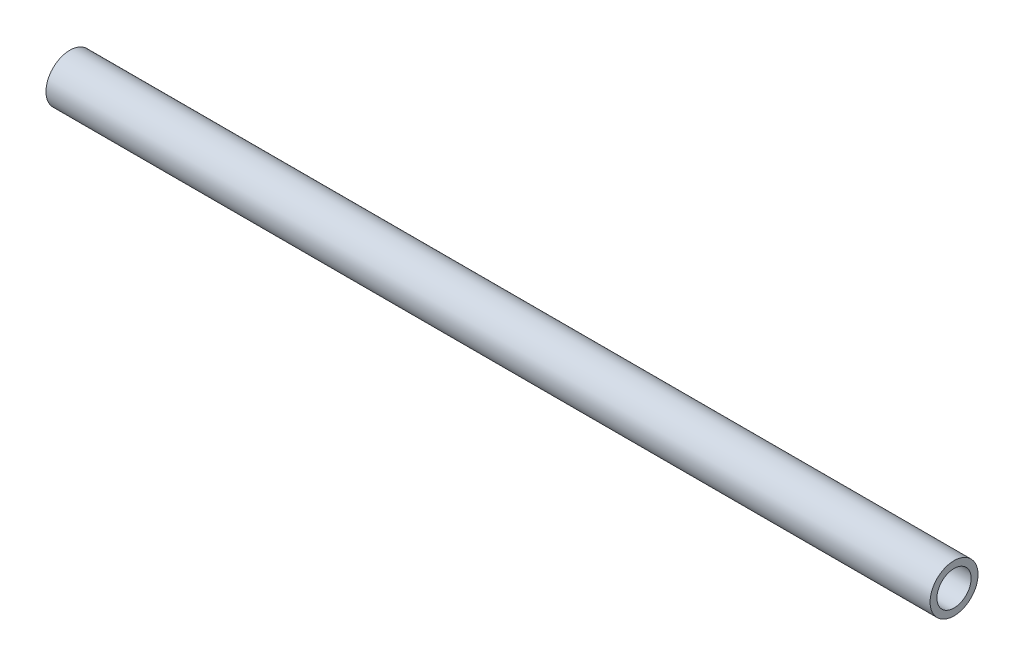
SolidWorks part; units mm, degrees
ref_plane "Front" through (0, 0, 0) normal (0, 0, 1) x (1, 0, 0)
ref_plane "Top" through (0, 0, 0) normal (0, 1, 0) x (1, 0, 0)
ref_plane "Right" through (0, 0, 0) normal (1, 0, 0) x (0, 0, -1)
sketch "Sketch1" plane through (0, 0, 0) normal (0, 0, 1) x (1, 0, 0)
  line L0 (0, 0) -> (393.7, 0)
  line L1 (9.9848, 0) -> (-9.9848, 0) construction
  dimension "D1" = 393.7
other "Structural Member1"
ref_plane "Plane1" through (0, 0, 0) normal (1, 0, 0) x (0, 0, -1)
sketch "Sketch11" plane through (0, 0, 0) normal (1, 0, 0) x (0, 0, -1)
  circle A0 centre (0, 0) radius 7.62
  circle A1 centre (0, 0) radius 10.668
  point P3 (0, 0)
  dimension "D1" = 21.336
  dimension "D2" = 15.24
